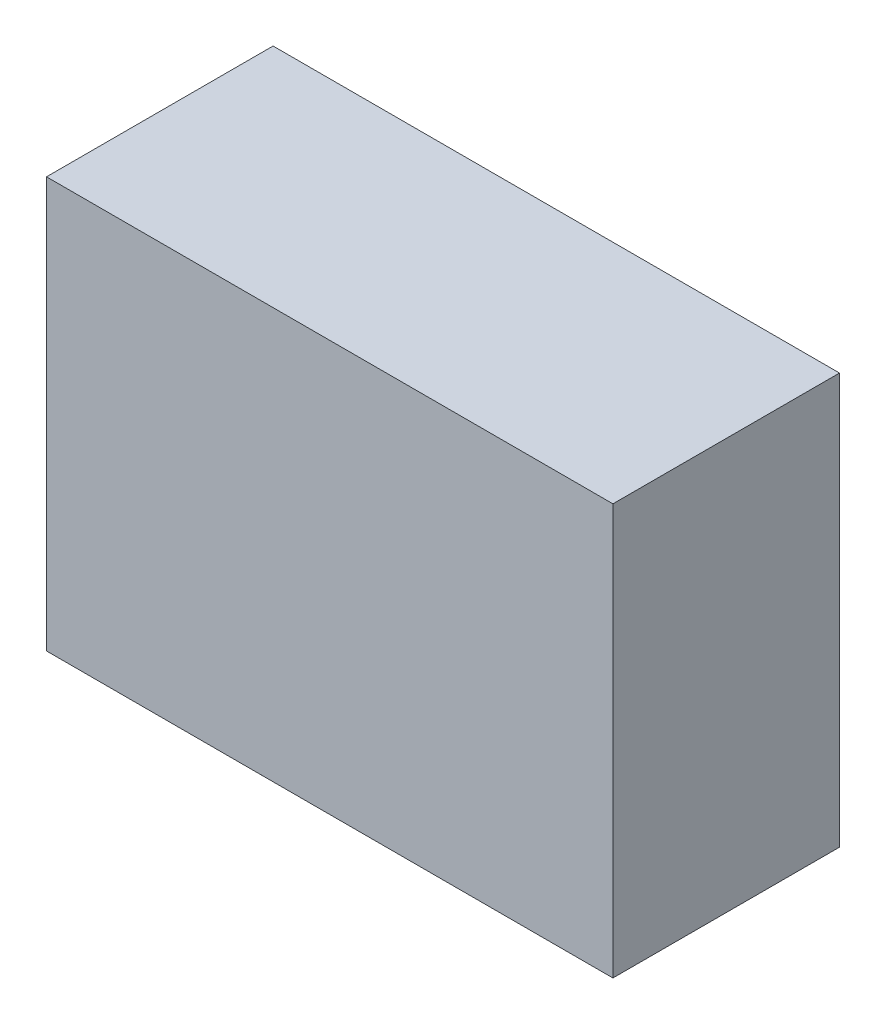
SolidWorks part; units mm, degrees
ref_plane "Plan de face" through (0, 0, 0) normal (0, 0, 1) x (1, 0, 0)
ref_plane "Plan de dessus" through (0, 0, 0) normal (0, 1, 0) x (1, 0, 0)
ref_plane "Plan de droite" through (0, 0, 0) normal (1, 0, 0) x (0, 0, -1)
sketch "Esquisse1" plane through (0, 0, 0) normal (0, 0, 1) x (1, 0, 0)
  line L1 (0, 0) -> (20, 0)
  line L2 (0, 0) -> (0, 14.5)
  line L3 (0, 14.5) -> (20, 14.5)
  line L4 (20, 0) -> (20, 14.5)
  dimension "D1" = 20
  dimension "D2" = 14.5
extrude "Extrusion1" add sketch "Esquisse1" along normal blind 8
